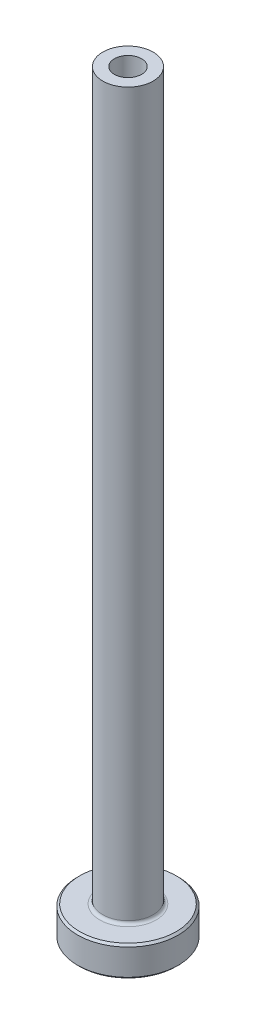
SolidWorks part; units mm, degrees
ref_plane "Front Plane" through (0, 0, 0) normal (0, 0, 1) x (1, 0, 0)
ref_plane "Top Plane" through (0, 0, 0) normal (0, 1, 0) x (1, 0, 0)
ref_plane "Right Plane" through (0, 0, 0) normal (1, 0, 0) x (0, 0, -1)
sketch "Sketch1" plane through (0, 0, 0) normal (0, 0, 1) x (1, 0, 0)
  line L0 (-1.35, 75) -> (-2.5, 75)
  line L1 (-2.5, 75) -> (-2.5, 3)
  line L2 (-2.5, 3) -> (-5, 3)
  line L3 (-5, 3) -> (-5, 0)
  line L4 (5.5, 0) -> (-5.5, 0) construction
  line L5 (-5, 0) -> (-1.6, 0)
  line L6 (-1.35, 30) -> (-1.35, 75)
  line L7 (0, 92.1877) -> (0, -15.5353) construction
  line L8 (0, -5.5) -> (0, 5.5) construction
  line L9 (-1.35, 30) -> (-1.6, 18)
  line L10 (-1.6, 18) -> (-1.6, 0)
  dimension "D1" = 0.25
  dimension "ID" = 2.7
  dimension "OD" = 5
  dimension "L" = 75
  dimension "H" = 10
  dimension "T" = 3
  dimension "N" = 45
  dimension "D2" = 12
revolve "Revolve1" add sketch "Sketch1" angle 360 about L7
fillet "Fillet1" radius 0.3 1 edges at (0, 3, 2.5)
chamfer "Chamfer1" distance 0.2 angle 45 2 edges at (0, 3, 5) (0, 0, 5)
chamfer "Chamfer3" distance 0.5 angle 45 1 edges at (0, 0, 1.6)
